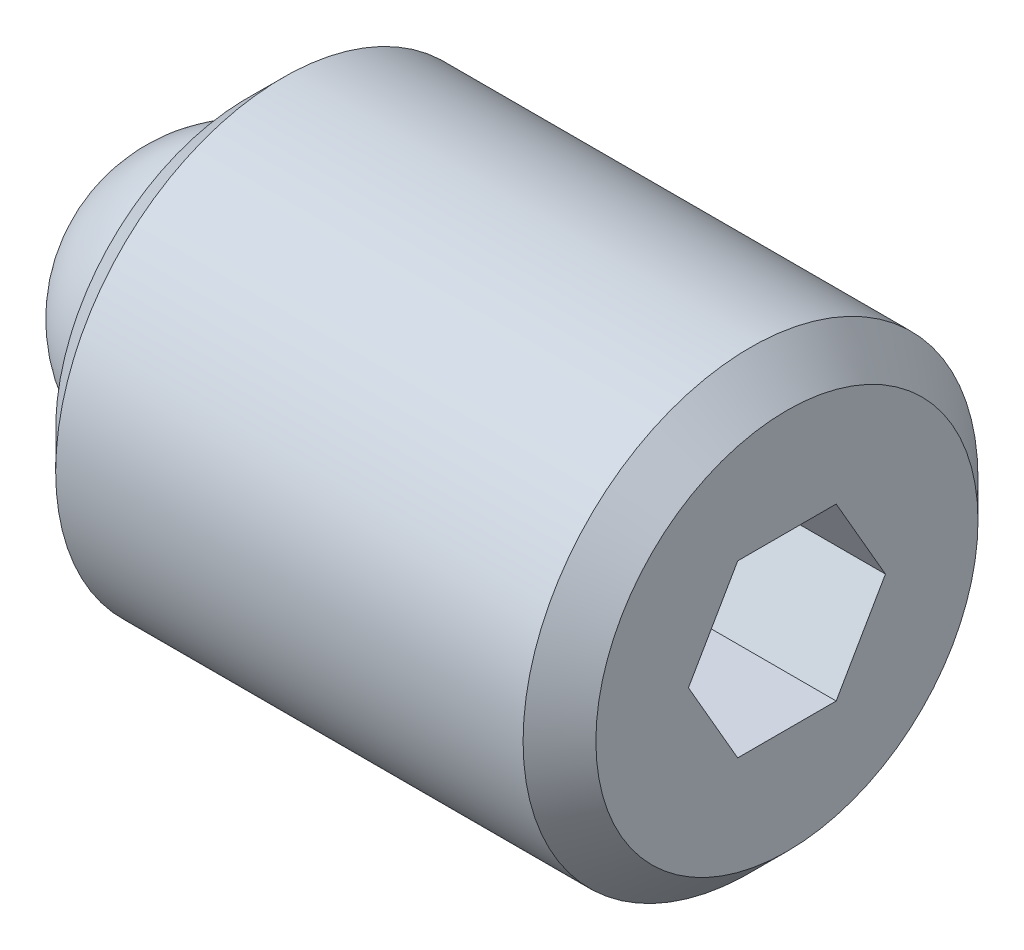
SolidWorks part; units mm, degrees
ref_plane "Front Plane" through (0, 0, 0) normal (0, 0, 1) x (1, 0, 0)
ref_plane "Top Plane" through (0, 0, 0) normal (0, 1, 0) x (1, 0, 0)
ref_plane "Right Plane" through (0, 0, 0) normal (1, 0, 0) x (0, 0, -1)
sketch "Sketch2" plane through (0, 0, 0) normal (1, 0, 0) x (0, 0, -1)
  circle A0 centre (0, 0) radius 3.175
  dimension "D1" = 6.35
extrude "Boss-Extrude1" add sketch "Sketch2" along normal blind 7.5406
sketch "Sketch3" plane through (0, 0, 0) normal (-1, 0, 0) x (0, 0, 1)
  circle A0 centre (0, 0) radius 1.9812
  dimension "D1" = 3.9624
chamfer "Chamfer1" distance 0.508 angle 45 1 edges at (0, 0, -3.175)
chamfer "Chamfer2" distance 0.508 angle 45 1 edges at (7.5406, 0, -3.175)
sketch "Sketch4" plane through (7.5406, 0, 0) normal (1, 0, 0) x (0, 0, -1)
  line L1 (1.3748, 0) -> (0.6874, 1.1906)
  line L2 (0.6874, 1.1906) -> (-0.6874, 1.1906)
  line L3 (-0.6874, 1.1906) -> (-1.3748, 0)
  line L4 (-1.3748, 0) -> (-0.6874, -1.1906)
  line L5 (-0.6874, -1.1906) -> (0.6874, -1.1906)
  line L6 (0.6874, -1.1906) -> (1.3748, 0)
  circle A0 centre (0, 0) radius 1.1906 construction
  dimension "D1" = 2.3813
extrude "Cut-Extrude2" cut sketch "Sketch4" against normal blind 2.286
extrude "Cut-Extrude3" cut sketch "Sketch3" against normal blind 1.9844
sketch "Sketch5" plane through (0, 0, 0) normal (-1, 0, 0) x (0, 0, 1)
  line L0 (0, 0) -> (0, -1.9844)
  line L1 (0, 0) -> (0, 1.9844)
  arc A0 (0, 1.9844) -> (0, -1.9844) centre (0, 0) ccw
  dimension "D1" = 1.9844
revolve "Revolve1" add sketch "Sketch5" angle 360 about L1
